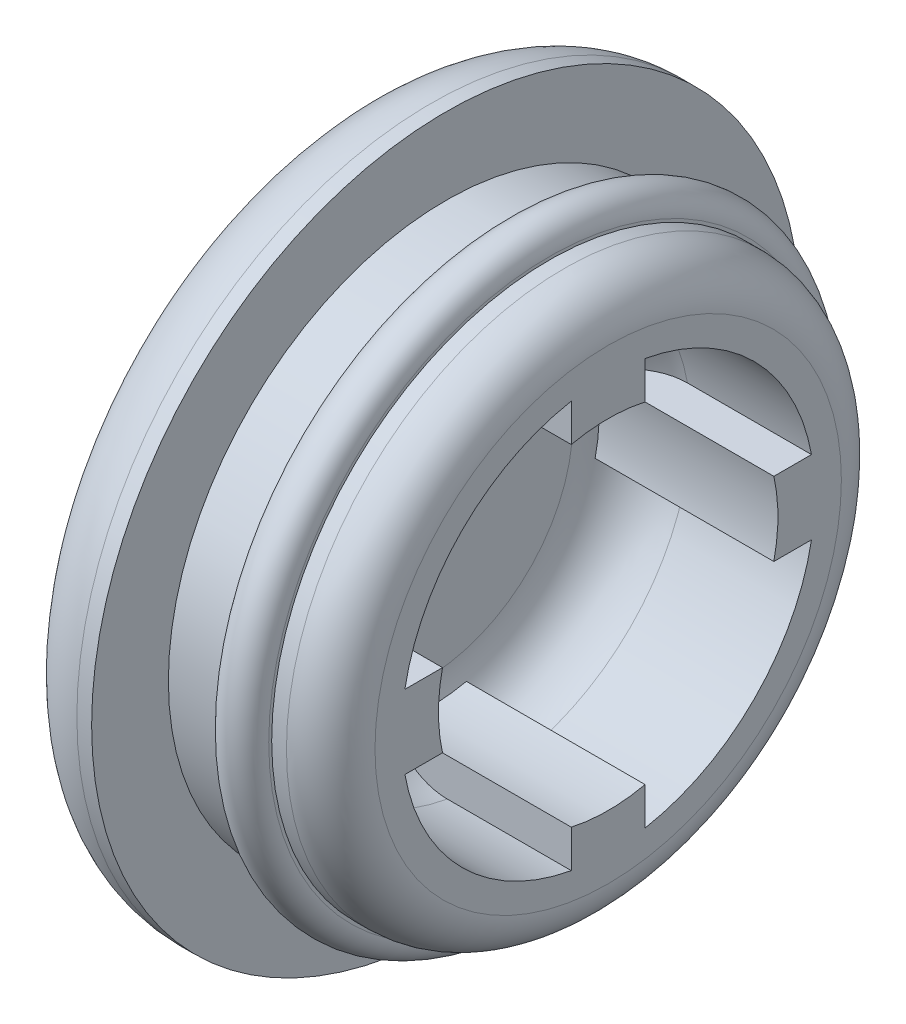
SolidWorks part; units mm, degrees
ref_plane "Plan de face" through (0, 0, 0) normal (0, 0, 1) x (1, 0, 0)
ref_plane "Plan de dessus" through (0, 0, 0) normal (0, 1, 0) x (1, 0, 0)
ref_plane "Plan de droite" through (0, 0, 0) normal (1, 0, 0) x (0, 0, -1)
sketch "Esquisse1" plane through (0, 0, 0) normal (0, 0, 1) x (1, 0, 0)
  line L0 (0, 0) -> (39.6784, 0) construction
  line L1 (0, 0) -> (0, 9.5)
  line L2 (2.5, 12) -> (3, 12)
  line L3 (3, 12) -> (3, 9.4)
  line L4 (3, 9.4) -> (5, 9.4)
  line L5 (5, 9.4) -> (5, 9.5)
  line L6 (0, 0) -> (2.3, 0)
  line L7 (6.5, 9.5) -> (6.5, 9.4)
  line L8 (6.5, 9.4) -> (7, 9.4)
  line L9 (8.5, 7.9) -> (8.5, 7)
  line L10 (8.5, 7) -> (4.3, 7)
  line L11 (2.3, 5) -> (2.3, 0)
  arc A0 (6.5, 9.5) -> (5, 9.5) centre (5.75, 9.5) ccw
  arc A1 (0, 9.5) -> (2.5, 12) centre (2.5, 9.5) cw
  arc A2 (7, 9.4) -> (8.5, 7.9) centre (7, 7.9) cw
  arc A4 (2.3, 5) -> (4.3, 7) centre (4.3, 5) cw
  point P17 (0, 12)
  point P22 (2.3, 7)
  dimension "D4" = 0.75
  dimension "D10" = 2.5
  dimension "D11" = 1.5
  dimension "D13" = 2
  dimension "D1" = 24
  dimension "D2" = 3
  dimension "D3" = 18.8
  dimension "D5" = 19
  dimension "D6" = 2
  dimension "D7" = 8.5
  dimension "D8" = 14
  dimension "D9" = 6.2
revolve "Révolution1" add sketch "Esquisse1" angle 360 about L0
sketch "Esquisse2" plane through (8.5, 0, 0) normal (1, 0, 0) x (0, 0, -1)
  line L0 (-1.25, 6.8875) -> (-1.25, 5.6125)
  line L1 (1.25, 6.8875) -> (1.25, 5.6125)
  line L2 (-6.8875, 1.25) -> (-5.6125, 1.25)
  line L3 (-6.8875, -1.25) -> (-5.6125, -1.25)
  line L4 (1.25, -5.6125) -> (1.25, -6.8875)
  line L5 (5.6125, 1.25) -> (6.8875, 1.25)
  line L6 (-1.25, -5.6125) -> (-1.25, -6.8875)
  line L7 (5.6125, -1.25) -> (6.8875, -1.25)
  circle A0 centre (0, 0) radius 7 construction
  arc A1 (1.25, 6.8875) -> (-1.25, 6.8875) centre (0, 0) ccw
  arc A3 (-6.8875, 1.25) -> (-6.8875, -1.25) centre (0, 0) ccw
  arc A4 (-1.25, -6.8875) -> (1.25, -6.8875) centre (0, 0) ccw
  arc A5 (6.8875, -1.25) -> (6.8875, 1.25) centre (0, 0) ccw
  arc A6 (1.25, 5.6125) -> (-1.25, 5.6125) centre (0, 0) ccw
  arc A7 (-5.6125, 1.25) -> (-5.6125, -1.25) centre (0, 0) ccw
  arc A8 (-1.25, -5.6125) -> (1.25, -5.6125) centre (0, 0) ccw
  arc A9 (5.6125, -1.25) -> (5.6125, 1.25) centre (0, 0) ccw
  dimension "D5" = 11.5
  dimension "D1" = 2.5
  dimension "D2" = 1.25
  dimension "D3" = 2.5
  dimension "D4" = 1.25
extrude "Extrusion1" add sketch "Esquisse2" against normal up to surface (6.054 mm away)
